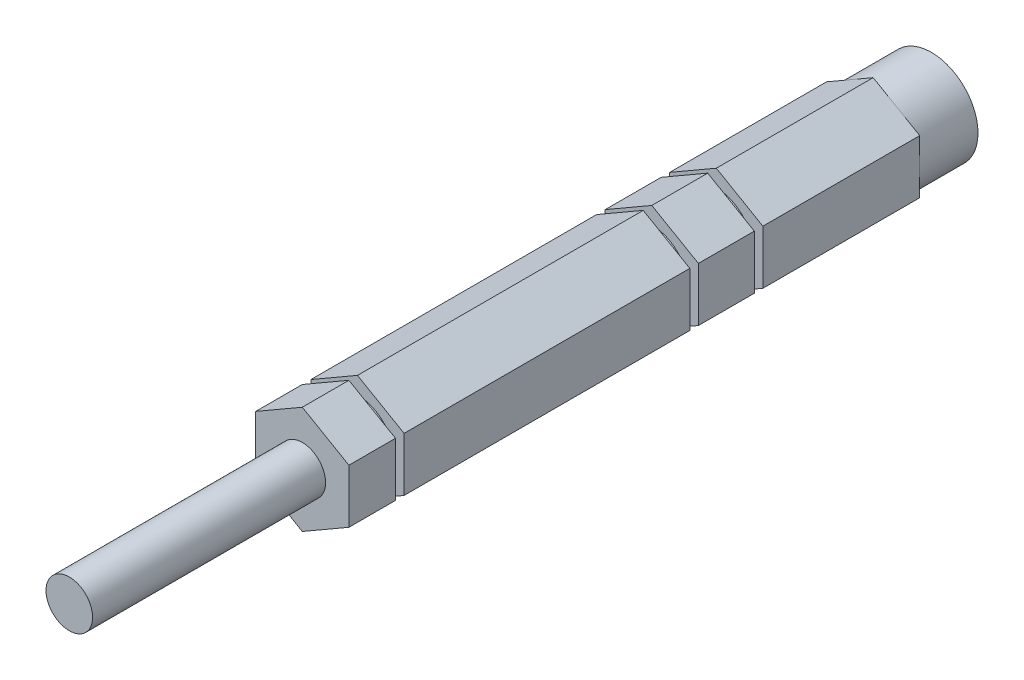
SolidWorks part; units mm, degrees
ref_plane "Front Plane" through (0, 0, 0) normal (0, 0, 1) x (1, 0, 0)
ref_plane "Top Plane" through (0, 0, 0) normal (0, 1, 0) x (1, 0, 0)
ref_plane "Right Plane" through (0, 0, 0) normal (1, 0, 0) x (0, 0, -1)
sketch "Sketch1" plane through (0, 0, 0) normal (0, 0, 1) x (1, 0, 0)
  line L1 (-6.35, 3.6662) -> (-6.35, -3.6662)
  line L2 (-6.35, -3.6662) -> (0, -7.3323)
  line L3 (0, -7.3323) -> (6.35, -3.6662)
  line L4 (6.35, -3.6662) -> (6.35, 3.6662)
  line L5 (6.35, 3.6662) -> (0, 7.3323)
  line L6 (0, 7.3323) -> (-6.35, 3.6662)
  circle A0 centre (0, 0) radius 6.35 construction
  dimension "D1" = 12.7
extrude "Boss-Extrude1" add sketch "Sketch1" along normal blind 117.475
sketch "Sketch2" [suppressed] plane through (0, 0, 114.3) normal (0, 0, 1) x (1, 0, 0)
  point P0 (0, 0)
sketch "Sketch3" [suppressed] plane through (0, 0, 0) normal (0, 0, -1) x (-1, 0, 0)
  point P0 (0, 0)
hole_wizard "#10-32 Tapped Hole1" positions "Sketch5" profile "Sketch4" tap size "#10-32" standard "ANSI Inch"
sketch "Sketch5" plane through (0, 0, 0) normal (0, 0, -1) x (-1, 0, 0)
  point P0 (0, 0)
sketch "Sketch4" plane through (0, 0, 0) normal (1, 0, 0) x (0, 1, 0)
  line L0 (0, 0) -> (0, 13.9133)
  line L1 (0, 13.9133) -> (2.0193, 12.7)
  line L2 (2.0193, 12.7) -> (2.0193, 0)
  line L5 (2.0193, 0) -> (0, 0)
  line L10 (0, 13.9133) -> (-2.0193, 12.7) construction
  line L11 (0, -6.35) -> (0, 107.95) construction
  dimension "Tap Drill Dia." = 4.0386
  dimension "Tap Drill Depth" = 12.7
  dimension "Drill Angle" = 118
hole_wizard "#10-32 Tapped Hole2" positions "Sketch7" profile "Sketch6" tap size "#10-32" standard "ANSI Inch"
sketch "Sketch7" [suppressed] plane through (0, 0, 114.3) normal (0, 0, 1) x (1, 0, 0)
  point P0 (0, 0)
sketch "Sketch6" plane through (0, 0, 114.3) normal (1, 0, 0) x (0, -1, 0)
  line L0 (0, 0) -> (0, 13.9133)
  line L1 (0, 13.9133) -> (2.0193, 12.7)
  line L2 (2.0193, 12.7) -> (2.0193, 0)
  line L5 (2.0193, 0) -> (0, 0)
  line L10 (0, 13.9133) -> (-2.0193, 12.7) construction
  line L11 (0, -6.35) -> (0, 107.95) construction
  dimension "Tap Drill Dia." = 4.0386
  dimension "Tap Drill Depth" = 12.7
  dimension "Drill Angle" = 118
sketch "Sketch8" plane through (0, 0, 0) normal (0, 1, 0) x (1, 0, 0)
  line L0 (6.35, 0) -> (6.35, -7.9375)
  line L1 (6.35, 0) -> (0, 0) construction
  line L2 (6.35, -7.9375) -> (17.0686, -7.9375)
  line L3 (17.0686, -7.9375) -> (17.0686, 0)
  line L4 (17.0686, 0) -> (6.35, 0)
  line L5 (3.175, -117.475) -> (3.175, -85.725)
  line L6 (6.35, -117.475) -> (0, -117.475) construction
  line L7 (3.175, -85.725) -> (17.0686, -85.725)
  line L8 (17.0686, -85.725) -> (17.0686, -117.475)
  line L9 (17.0686, -117.475) -> (3.175, -117.475)
  line L10 (0, -117.475) -> (0, 0) construction
  line L11 (0, 0) -> (0, -117.475) construction
  dimension "D1" = 6.35
  dimension "D2" = 7.9375
  dimension "D3" = 3.175
  dimension "D4" = 31.75
revolve "Cut-Revolve1" cut sketch "Sketch8" angle 360 about L11
ref_plane "Plane1" through (0, 0, 0) normal (0.5, 0.866, 0) x (0.866, -0.5, 0)
sketch "Sketch9" plane through (0, 0, 0) normal (0.5, 0.866, 0) x (0.866, -0.5, 0)
  line L0 (7.3323, -85.725) -> (7.3323, -7.9375) construction
  line L1 (7.3323, -29.3116) -> (5.0292, -29.3116)
  line L2 (7.3323, -29.3116) -> (7.3323, -30.48)
  line L3 (7.3323, -30.48) -> (5.0292, -30.48)
  line L4 (5.0292, -29.3116) -> (5.0292, -30.48)
  line L5 (0, 0) -> (0, -117.475) construction
  line L6 (7.3323, -38.1) -> (5.0292, -38.1)
  line L7 (7.3323, -38.1) -> (7.3323, -39.2684)
  line L8 (7.3323, -39.2684) -> (5.0292, -39.2684)
  line L9 (5.0292, -38.1) -> (5.0292, -39.2684)
  line L10 (7.3323, -78.2066) -> (5.0292, -78.2066)
  line L11 (7.3323, -78.2066) -> (7.3323, -79.375)
  line L12 (7.3323, -79.375) -> (5.0292, -79.375)
  line L13 (5.0292, -78.2066) -> (5.0292, -79.375)
  line L18 (-3.175, -117.475) -> (3.175, -117.475) construction
  line L20 (6.35, 0) -> (-6.35, 0) construction
  dimension "D1" = 1.1684
  dimension "D2" = 10.0584
  dimension "D3" = 41.275
  dimension "D4" = 7.62
  dimension "D6" = 30.48
revolve "Cut-Revolve2" cut sketch "Sketch9" angle 360 about L5
